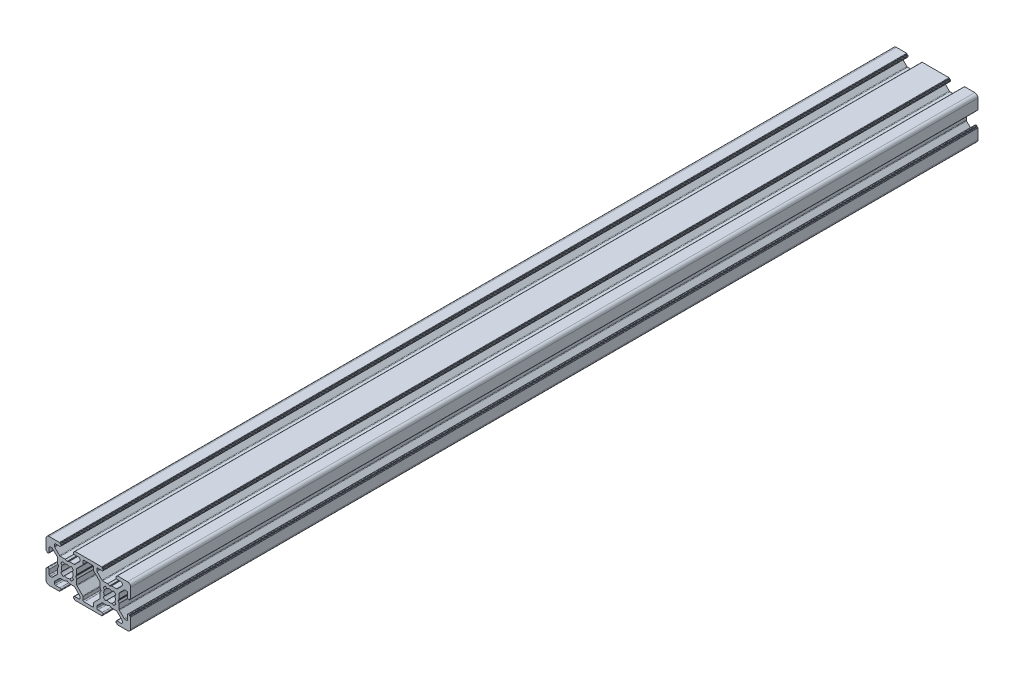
SolidWorks part; units mm, degrees
ref_plane "Front Plane" through (0, 0, 0) normal (0, 0, 1) x (1, 0, 0)
ref_plane "Top Plane" through (0, 0, 0) normal (0, 1, 0) x (1, 0, 0)
ref_plane "Right Plane" through (0, 0, 0) normal (1, 0, 0) x (0, 0, -1)
imported_body "al-profil-20x40-drazka-6.stp<1>"
other "Move Face1" parameters "D1"=600
